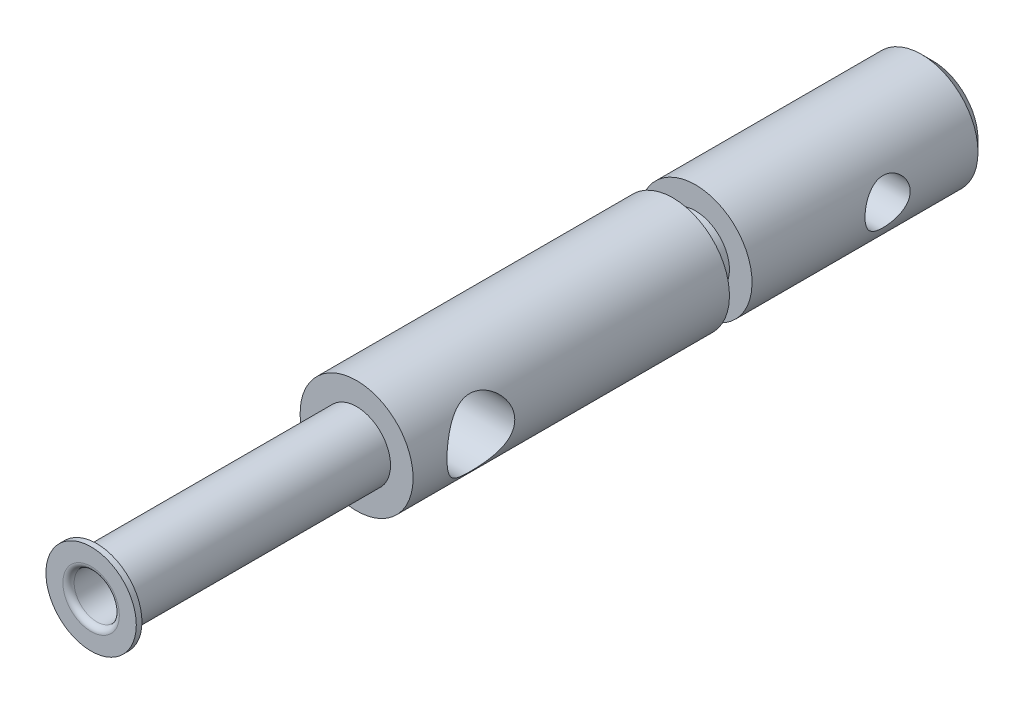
SolidWorks part; units mm, degrees
ref_plane "Plan de face" through (0, 0, 0) normal (0, 0, 1) x (1, 0, 0)
ref_plane "Plan de dessus" through (0, 0, 0) normal (0, 1, 0) x (1, 0, 0)
ref_plane "Plan de droite" through (0, 0, 0) normal (1, 0, 0) x (0, 0, -1)
sketch "Esquisse1" plane through (0, 0, 0) normal (0, 0, 1) x (1, 0, 0)
  circle A0 centre (0, 0) radius 5
  dimension "D1" = 10
extrude "Extrusion1" add sketch "Esquisse1" along normal blind 51
chamfer "Chanfrein1" distance 1 angle 45 1 edges at (5, 0, 0)
sketch "Esquisse2" plane through (0, 0, 51) normal (0, 0, 1) x (1, 0, 0)
  circle A0 centre (0, 0) radius 3
  dimension "D1" = 6
extrude "Extrusion2" add sketch "Esquisse2" along normal blind 23
sketch "Esquisse3" plane through (0, 0, 74) normal (0, 0, 1) x (1, 0, 0)
  circle A0 centre (0, 0) radius 4
  dimension "D1" = 8
extrude "Extrusion3" add sketch "Esquisse3" along normal blind 0.5
hole_wizard "Diamètre du perçage Ø4.0 (4)1" positions "Esquisse5" profile "Esquisse4" hole size "Ø4.0" standard "ISO"
sketch "Esquisse5" plane through (0, 0, 74.5) normal (0, 0, 1) x (1, 0, 0)
  point P0 (0, 0)
sketch "Esquisse4" plane through (0, 0, 74.5) normal (1, 0, 0) x (0, -1, 0)
  line L0 (0, 0) -> (0, 6.2017)
  line L1 (0, 6.2017) -> (2, 5)
  line L2 (2, 5) -> (2, 0)
  line L5 (2, 0) -> (0, 0)
  line L10 (0, 6.2017) -> (-2, 5) construction
  line L11 (0, -6.35) -> (0, 107.95) construction
  dimension "Diamètre du perçage" = 4
  dimension "Profondeur du perçage" = 5
  dimension "Angle de pointe" = 118
fillet "Congé1" radius 0.5 1 edges at (2, 0, 74.5)
sketch "Esquisse6" plane through (0, 0, 0) normal (1, 0, 0) x (0, 0, -1)
  line L0 (0, 0) -> (-79.0533, 0) construction
  circle A0 centre (-9, 0) radius 2
  circle A1 centre (-45, 0) radius 3
  dimension "D1" = 4
  dimension "D2" = 6
  dimension "D3" = 9
  dimension "D4" = 45
extrude "Enlèv. mat.-Extru.1" cut sketch "Esquisse6" against normal through all and the other way through all
sketch "Esquisse7" plane through (0, 0, 0) normal (1, 0, 0) x (0, 0, -1)
  line L0 (-1, 5) -> (-51, 5) construction
  line L1 (-23, 5) -> (-21, 5)
  line L2 (-23, 5) -> (-23, 3)
  line L3 (-23, 3) -> (-21, 3)
  line L4 (-21, 5) -> (-21, 3)
  line L5 (0, 0) -> (-45, 0) construction
  line L6 (-22, -2.5709) -> (-22, 12.649) construction
  dimension "D1" = 2
  dimension "D2" = 3
  dimension "D3" = 21
revolve "Enlèvement de matière-Révolution1" cut sketch "Esquisse7" angle 360 about L5
